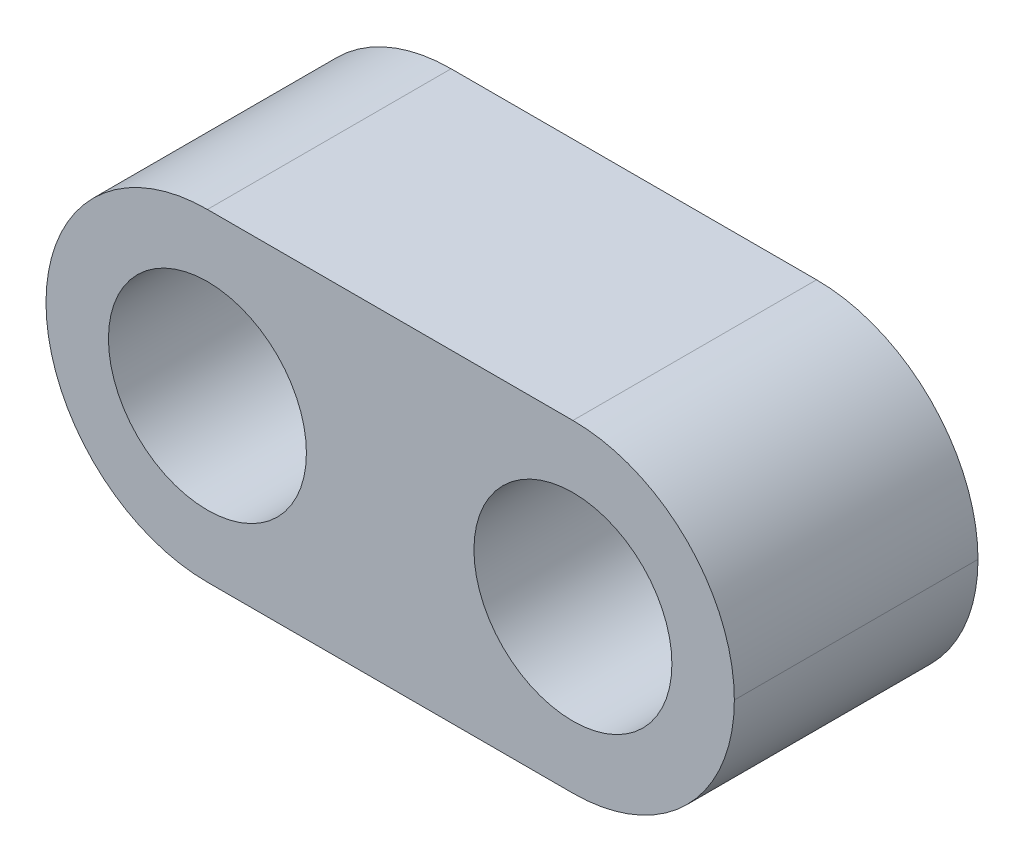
SolidWorks part; units mm, degrees
ref_plane "Piano frontale" through (0, 0, 0) normal (0, 0, 1) x (1, 0, 0)
ref_plane "Piano superiore" through (0, 0, 0) normal (0, 1, 0) x (1, 0, 0)
ref_plane "Piano destro" through (0, 0, 0) normal (1, 0, 0) x (0, 0, -1)
sketch "Schizzo1" plane through (0, 0, 0) normal (0, 0, 1) x (1, 0, 0)
  line L1 (-5.65, -2.65) -> (5.65, -2.65)
  line L2 (-5.65, -2.65) -> (-5.65, 2.65)
  line L3 (-5.65, 2.65) -> (5.65, 2.65)
  line L4 (5.65, -2.65) -> (5.65, 2.65)
  line L5 (-5.65, -2.65) -> (5.65, 2.65) construction
  line L6 (-5.65, 2.65) -> (5.65, -2.65) construction
  point P0 (0, 0)
  dimension "D1" = 5.3
  dimension "D2" = 11.3
extrude "Estrusione-Estrusione1" add sketch "Schizzo1" along normal blind 4
sketch "Schizzo2" plane through (0, 0, 0) normal (0, 0, -1) x (-1, 0, 0)
  circle A0 centre (3, 0) radius 1.625
  circle A1 centre (-3, 0) radius 1.625
  dimension "D1" = 3.25
  dimension "D2" = 6
  dimension "D3" = 3
extrude "Taglio-Estrusione1" cut sketch "Schizzo2" against normal through all
fillet "Raccordo1" radius 2.65 4 edges at (5.65, 2.65, 2) (5.65, -2.65, 2) (-5.65, -2.65, 2) (-5.65, 2.65, 2)
